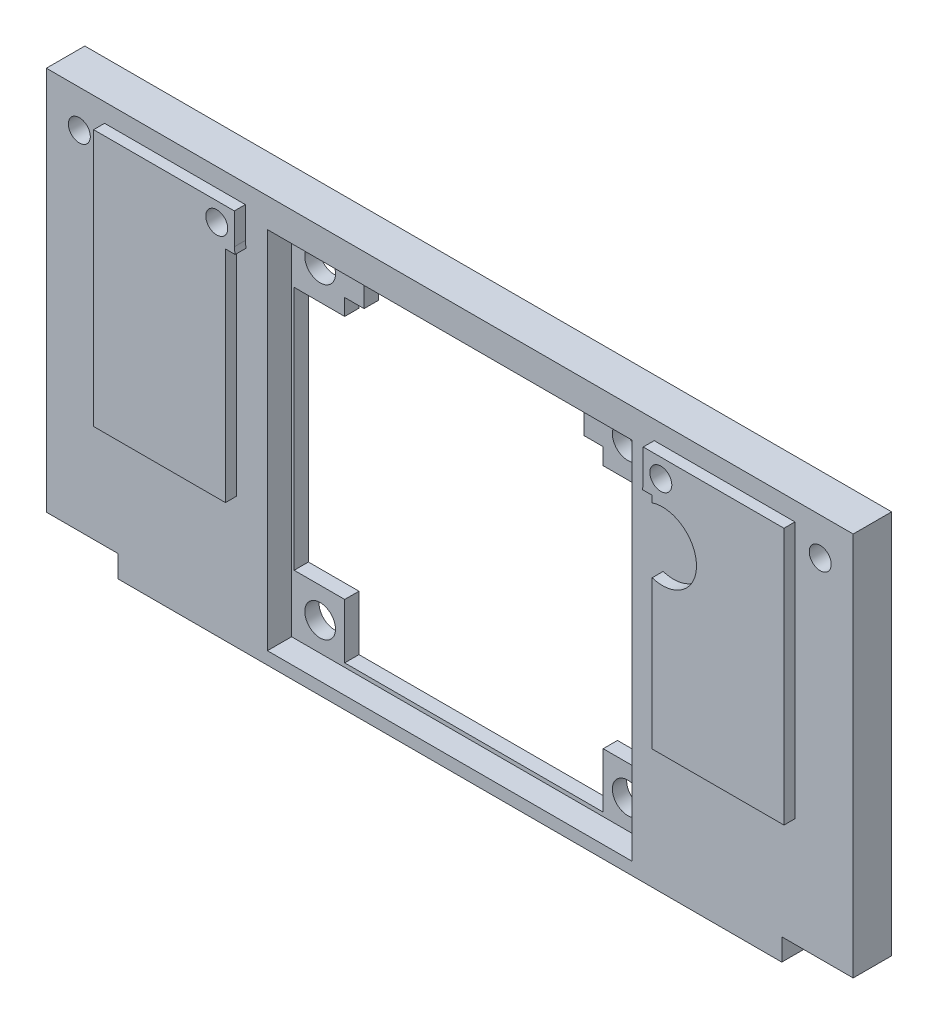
SolidWorks part; units mm, degrees
ref_plane "Front Plane" through (0, 0, 0) normal (0, 0, 1) x (1, 0, 0)
ref_plane "Top Plane" through (0, 0, 0) normal (0, 1, 0) x (1, 0, 0)
ref_plane "Right Plane" through (0, 0, 0) normal (1, 0, 0) x (0, 0, -1)
sketch "Sketch3" plane through (0, 0, 0) normal (0, 0, 1) x (1, 0, 0)
  line L0 (-39.9368, -0.9626) -> (-39.9368, 36.0374)
  line L1 (-3.2168, 30.7779) -> (-3.2168, 32.6429) construction
  line L2 (-34.7809, 21.6224) -> (-21.3928, 21.6224) construction
  line L3 (-30.5893, -0.9626) -> (18.3407, -0.9626) construction
  line L4 (-9.7818, 10.2129) -> (-9.7818, 23.3429) construction
  line L5 (-9.7818, 23.3429) -> (3.3482, 23.3429) construction
  line L6 (3.3482, 23.3429) -> (3.3482, 10.2129) construction
  line L7 (3.3482, 10.2129) -> (-9.7818, 10.2129) construction
  line L9 (-39.9368, -0.9626) -> (-14.8318, -0.9626)
  line L10 (-14.9818, 0.5374) -> (-14.9818, 5.5374)
  line L11 (-14.9818, 29.3429) -> (8.5482, 29.3429)
  line L12 (8.5482, 29.3429) -> (8.5482, 27.8429)
  line L13 (7.2982, -0.9626) -> (33.5032, -0.9626)
  line L14 (33.5032, -0.9626) -> (33.5032, 36.0374)
  line L15 (33.5032, 36.0374) -> (-39.9368, 36.0374)
  line L16 (-36.9368, 32.6429) -> (-23.4268, 32.6429) construction
  line L17 (-23.4268, 32.6429) -> (16.9932, 32.6429) construction
  line L18 (16.9932, 32.6429) -> (30.5032, 32.6429) construction
  line L19 (-17.2168, 30.7779) -> (10.7832, 30.7779) construction
  line L20 (-3.2168, 30.7779) -> (-3.2168, 23.3429) construction
  line L21 (-3.2168, 23.3429) -> (-3.2168, 10.2129) construction
  line L22 (-3.2168, 32.6429) -> (-3.2168, 42.2345) construction
  line L23 (-14.8318, -0.9626) -> (7.2982, -0.9626)
  line L24 (8.5482, 0.5374) -> (-14.9818, 0.5374)
  line L25 (-14.9818, 27.8429) -> (-19.5818, 27.8429)
  line L26 (-19.5818, 27.8429) -> (-19.5818, 5.5374)
  line L27 (-19.5818, 5.5374) -> (-14.9818, 5.5374)
  line L28 (-14.9818, 27.8429) -> (-14.9818, 29.3429)
  line L29 (8.5482, 5.5374) -> (13.1482, 5.5374)
  line L30 (13.1482, 5.5374) -> (13.1482, 27.8429)
  line L31 (13.1482, 27.8429) -> (8.5482, 27.8429)
  line L32 (8.5482, 5.5374) -> (8.5482, 0.5374)
  line L35 (-17.2168, 30.7779) -> (-17.2168, 2.7779) construction
  line L36 (-17.2168, 2.7779) -> (10.7832, 2.7779) construction
  line L37 (10.7832, 2.7779) -> (10.7832, 30.7779) construction
  circle A0 centre (-17.2168, 30.7779) radius 1.4
  circle A1 centre (-36.9368, 32.6429) radius 1
  circle A2 centre (-23.4268, 32.6429) radius 1
  circle A3 centre (16.9932, 32.6429) radius 1
  circle A4 centre (30.5032, 32.6429) radius 1
  circle A5 centre (-36.9368, 32.6429) radius 1
  circle A6 centre (-23.4268, 32.6429) radius 1
  circle A7 centre (-17.2168, 30.7779) radius 1.4
  circle A8 centre (-17.2168, 2.7779) radius 1.4
  circle A9 centre (10.7832, 30.7779) radius 1.4
  circle A10 centre (10.7832, 2.7779) radius 1.4
  point P47 (10.8482, 27.8429)
  dimension "D16" = 2
  dimension "D17" = 2.8
  dimension "D1" = 13.51
  dimension "D2" = 40.42
  dimension "D3" = 13.51
  dimension "D4" = 3.3945
  dimension "D5" = 28
  dimension "D6" = 1.865
  dimension "D7" = 13.13
  dimension "D8" = 13.13
  dimension "D9" = 7.435
  dimension "D10" = 3
  dimension "D11" = 3
  dimension "D12" = 5.2
  dimension "D13" = 5.2
  dimension "D14" = 6
  dimension "D15" = 37
  dimension "D18" = 1.5
  dimension "D19" = 5
  dimension "D20" = 9.8
  dimension "D22" = 1.5
  dimension "D23" = 9.8
  dimension "D24" = 28
extrude "Boss-Extrude1" add sketch "Sketch3" along normal blind 3.5 contours L14 L15 L0 L9 L10 L11 L12 L13 A9 A4 A3 A2 A1 A0
sketch "Sketch13" plane through (0, 0, 0) normal (0, 0, -1) x (-1, 0, 0)
  line L0 (-33.5032, 36.0374) -> (39.9368, 36.0374) construction
  line L1 (-33.5032, 36.0374) -> (-16.1332, 36.0374)
  line L2 (-33.5032, 36.0374) -> (-33.5032, -0.9626)
  line L3 (-33.5032, -0.9626) -> (-16.1332, -0.9626)
  line L4 (-16.1332, 36.0374) -> (-16.1332, -0.9626)
  line L5 (39.9368, -0.9626) -> (-33.5032, -0.9626) construction
  line L7 (22.5668, 36.0374) -> (39.9368, 36.0374)
  line L8 (22.5668, 36.0374) -> (22.5668, -0.9626)
  line L9 (22.5668, -0.9626) -> (39.9368, -0.9626)
  line L10 (39.9368, 36.0374) -> (39.9368, -0.9626)
  line L11 (3.2168, 36.0374) -> (3.2168, 44.4839) construction
  line L12 (3.2168, 36.0374) -> (-16.1332, 36.0374) construction
  line L13 (3.2168, 36.0374) -> (22.5668, 36.0374) construction
  line L14 (-33.5032, -0.9626) -> (-33.5032, 36.0374) construction
  dimension "D1" = 38.7
extrude "Boss-Extrude3" [suppressed] add sketch "Sketch13" along normal blind 1
sketch "Sketch9" plane through (0, 0, 3.5) normal (0, 0, -1) x (-1, 0, 0)
  line L1 (-10.7832, 30.7779) -> (-8.9447, 28.9394) construction
  line L2 (17.2168, 2.7779) -> (17.2168, 30.7779) construction
  line L3 (17.2168, 30.7779) -> (-10.7832, 2.7779) construction
  line L4 (3.2168, 16.7779) -> (17.2168, 2.7779) construction
  line L5 (3.2168, 16.7779) -> (-10.7832, 30.7779) construction
  line L7 (-13.3832, 0.1779) -> (19.8168, 0.1779)
  line L8 (-13.3832, 0.1779) -> (-13.3832, 33.3779)
  line L9 (-13.3832, 33.3779) -> (19.8168, 33.3779)
  line L10 (19.8168, 0.1779) -> (19.8168, 33.3779)
  line L11 (-13.3832, 0.1779) -> (19.8168, 33.3779) construction
  line L12 (-13.3832, 33.3779) -> (19.8168, 0.1779) construction
  dimension "D2" = 33.2
extrude "Cut-Extrude1" cut sketch "Sketch9" along normal blind 2.2
sketch "Sketch10" plane through (0, 0, 0) normal (0, 0, -1) x (-1, 0, 0)
  line L0 (14.9818, 29.3429) -> (-8.5482, 29.3429) construction
  line L1 (-6.7832, 31.8429) -> (13.2168, 31.8429)
  line L2 (-6.7832, 31.8429) -> (-6.7832, 29.3429)
  line L3 (-6.7832, 29.3429) -> (13.2168, 29.3429)
  line L4 (13.2168, 31.8429) -> (13.2168, 29.3429)
  point P4 (3.2168, 29.3429)
  dimension "D1" = 2.5
  dimension "D2" = 20
extrude "Cut-Extrude2" cut sketch "Sketch10" against normal blind 1.75
sketch "Sketch11" plane through (0, 0, 3.5) normal (0, 0, 1) x (1, 0, 0)
  line L0 (-36.9368, 32.6429) -> (-23.4268, 32.6429) construction
  line L1 (-34.6368, 30.9429) -> (-34.6368, 10.9429)
  line L9 (-21.8268, 34.3429) -> (-34.6368, 34.3429)
  line L14 (-34.6368, 30.9429) -> (-34.6368, 34.3429)
  line L17 (-34.6368, 10.9429) -> (-22.6368, 10.9429)
  line L18 (-22.6368, 30.9429) -> (-22.6368, 10.9429)
  line L19 (-27.6818, 10.9429) -> (-27.6818, 4.0347) construction
  line L20 (-21.8268, 34.3429) -> (-21.8268, 31.5137)
  line L21 (-22.6368, 30.9429) -> (-21.7519, 30.9429)
  circle A1 centre (-36.9368, 32.6429) radius 1 construction
  circle A2 centre (-23.4268, 32.6429) radius 1
  circle A5 centre (-23.4268, 32.6429) radius 1 construction
  arc A6 (-21.8268, 31.5137) -> (-21.7519, 30.9429) centre (-18.1406, 31.707) ccw
  point P2 (-27.6818, 32.6429)
  point P16 (-34.6368, 32.6429)
  dimension "D1" = 1.6
  dimension "D2" = 12
  dimension "D3" = 2.3
  dimension "D5" = 20
extrude "Boss-Extrude2" add sketch "Sketch11" along normal blind 1
ref_plane "Plane1" through (-3.2168, 0, 0) normal (-1, 0, 0) x (0, 0, 1)
mirror "Mirror1" about plane through (-3.2168, 0, 0) normal (-1, 0, 0) of "Boss-Extrude2"
sketch "Sketch14" plane through (0, 0, 4.5) normal (0, 0, 1) x (1, 0, 0)
  circle A1 centre (17.1422, 27.3923) radius 3.1
  circle A2 centre (16.9932, 32.6429) radius 1 construction
  circle A3 centre (30.5032, 32.6429) radius 1 construction
  dimension "D1" = 6.2
  dimension "D2" = 5.2506
  dimension "D3" = 13.361
extrude "Cut-Extrude3" cut sketch "Sketch14" against normal up to surface (1 mm away)
sketch "Sketch15" plane through (0, 0, 3.5) normal (0, 0, 1) x (1, 0, 0)
  line L1 (-39.9368, -0.9626) -> (-33.4368, -0.9626)
  line L2 (-39.9368, -0.9626) -> (-39.9368, 1.0374)
  line L3 (-39.9368, 1.0374) -> (-33.4368, 1.0374)
  line L4 (-33.4368, -0.9626) -> (-33.4368, 1.0374)
  line L5 (33.5032, -0.9626) -> (27.0032, -0.9626)
  line L6 (33.5032, -0.9626) -> (33.5032, 1.0374)
  line L7 (33.5032, 1.0374) -> (27.0032, 1.0374)
  line L8 (27.0032, -0.9626) -> (27.0032, 1.0374)
  dimension "D1" = 6.5
  dimension "D2" = 2
extrude "Cut-Extrude4" cut sketch "Sketch15" against normal through all
